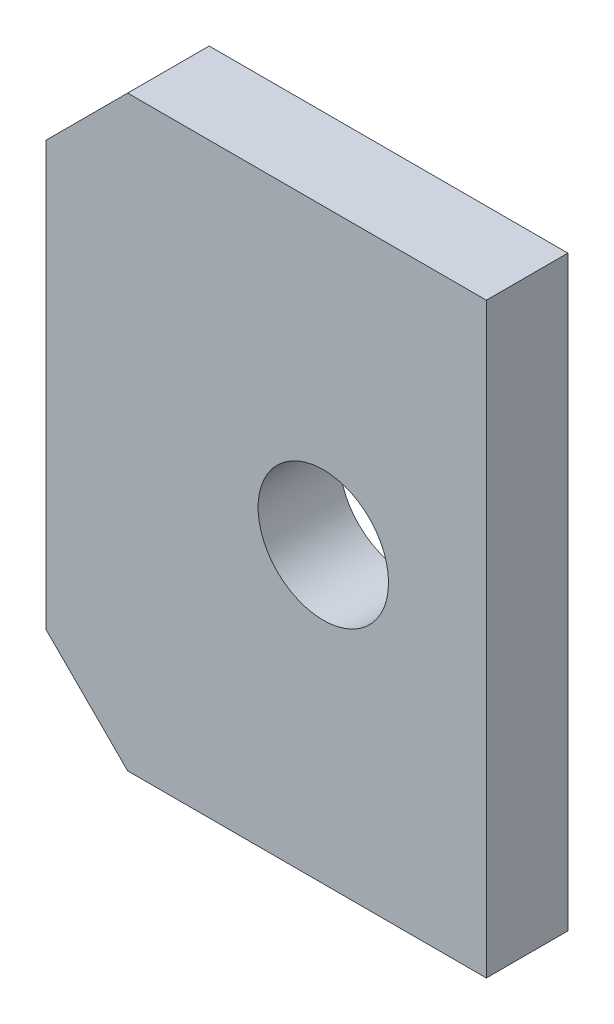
SolidWorks part; units mm, degrees
ref_plane "Přední" through (0, 0, 0) normal (0, 0, 1) x (1, 0, 0)
ref_plane "Horní" through (0, 0, 0) normal (0, 1, 0) x (1, 0, 0)
ref_plane "Pravá" through (0, 0, 0) normal (1, 0, 0) x (0, 0, -1)
sketch "Skica1" plane through (0, 0, 0) normal (0, 0, 1) x (1, 0, 0)
  line L0 (13.5, 18) -> (-13.5, -18) construction
  line L1 (-13.5, 18) -> (13.5, 18)
  line L2 (-13.5, 18) -> (-13.5, -18)
  line L3 (-13.5, -18) -> (13.5, -18)
  line L4 (13.5, 18) -> (13.5, -18)
  dimension "D1" = 36
  dimension "D2" = 27
extrude "Vysunout1" add sketch "Skica1" along normal blind 5
hole_wizard "M9.0 (9.000000) průměrové díry1" positions "Skica3" profile "Skica2" hole size "M9.0" standard "ISO"
sketch "Skica3" plane through (0, 0, 5) normal (0, 0, 1) x (1, 0, 0)
  line L0 (13.5, -18) -> (13.5, 18) construction
  point P0 (3.5, 0)
  dimension "D1" = 10
sketch "Skica2" plane through (3.5, 0, 5) normal (1, 0, 0) x (0, -1, 0)
  line L0 (0, 0) -> (0, 17.4034)
  line L1 (0, 17.4034) -> (4, 15)
  line L2 (4, 15) -> (4, 0)
  line L5 (4, 0) -> (0, 0)
  line L10 (0, 17.4034) -> (-4, 15) construction
  line L11 (0, -6.35) -> (0, 107.95) construction
  dimension "Prùmìr díry" = 8
  dimension "Hloubka díry" = 15
  dimension "Úhel vrtání" = 118
chamfer "Zkosit1" distance 5 angle 45 2 edges at (-13.5, -18, 2.5) (-13.5, 18, 2.5)
